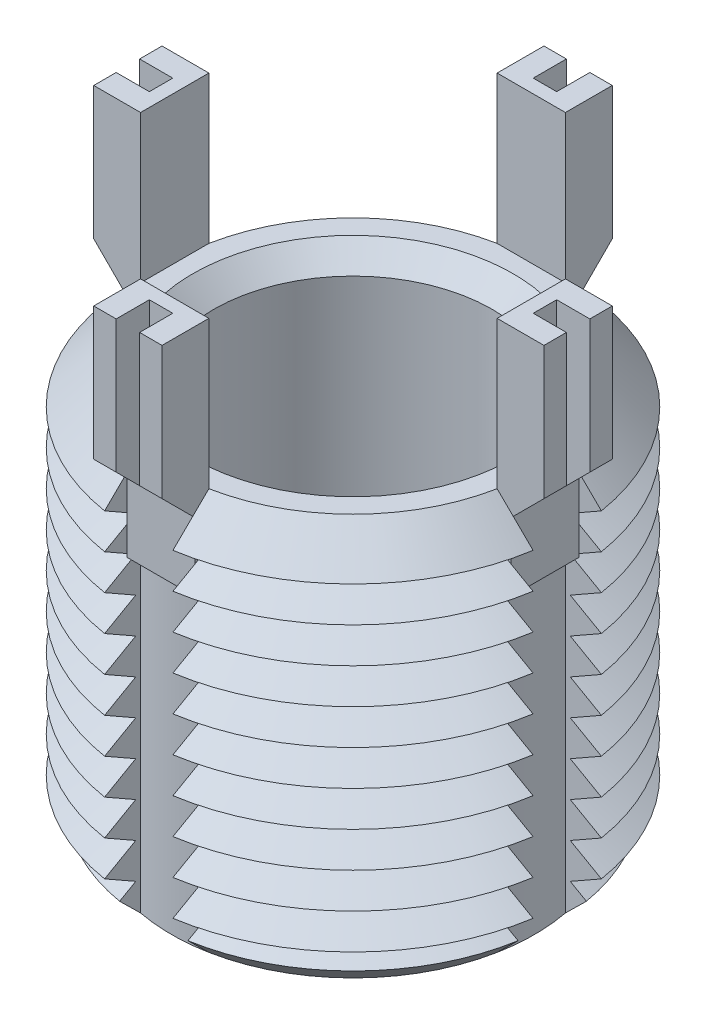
SolidWorks part; units mm, degrees
ref_plane "Front Plane" through (0, 0, 0) normal (0, 0, 1) x (1, 0, 0)
ref_plane "Top Plane" through (0, 0, 0) normal (0, 1, 0) x (1, 0, 0)
ref_plane "Right Plane" through (0, 0, 0) normal (1, 0, 0) x (0, 0, -1)
sketch "Sketch1" plane through (0, 0, 0) normal (0, 1, 0) x (1, 0, 0)
  circle A0 centre (0, 0) radius 11.1125
  dimension "D1" = 22.225
extrude "Boss-Extrude1" add sketch "Sketch1" against normal blind 20.574
chamfer "Chamfer1" distance 1.814 angle 45 2 edges at (0, -20.574, 11.1125) (0, 0, 11.1125)
sketch "Sketch2" plane through (0, 0, 0) normal (1, 0, 0) x (0, 0, -1)
  line L0 (0, 0.8859) -> (0, -9.2617) construction
sketch "Sketch3" plane through (0, 0, 0) normal (1, 0, 0) x (0, 0, -1)
  line L0 (-11.1125, -1.814) -> (-9.5415, -2.721)
  line L1 (-9.5415, -2.721) -> (-11.1125, -3.628)
  line L2 (-11.1125, -1.814) -> (-11.1125, -18.76) construction
  line L3 (-11.1125, -3.628) -> (-11.1125, -1.814)
  dimension "D1" = 1.814
revolve "Cut-Revolve1" cut sketch "Sketch3" angle 360 about L0
pattern_linear "LPattern1" count 10 spacing 1.814 along (0, -1, 0) of "Cut-Revolve1"
sketch "Sketch4" plane through (0, 0, 0) normal (0, 1, 0) x (1, 0, 0)
  line L0 (-9.1323, 1.75) -> (-10.9738, 1.75)
  line L2 (-10.9738, -1.75) -> (-9.1323, -1.75)
  arc A0 (-9.1323, 1.75) -> (-9.1323, -1.75) centre (0, 0) ccw
  arc A1 (-10.9738, 1.75) -> (-10.9738, -1.75) centre (0, 0) ccw
  circle A2 centre (0, 0) radius 11.1125 construction
  circle A3 centre (0, 0) radius 9.2985 construction
  point P1 (-9.2985, 0)
  point P3 (-11.1125, 0)
  point P13 (0, 0)
  dimension "D1" = 3.5
extrude "Cut-Extrude1" cut sketch "Sketch4" against normal up to surface (20.574 mm away)
pattern_circular "CirPattern1" count 4 over 360 about axis through (0, 0, 0) along (0, 1, 0) of "Cut-Extrude1"
sketch "Sketch5" plane through (0, 0, 0) normal (1, 0, 0) x (0, 0, -1)
  line L0 (-9.1323, 7.558) -> (-9.1323, -4.442)
  line L1 (-9.1323, -4.442) -> (-9.8323, -4.442)
  line L2 (-9.8323, -4.442) -> (-9.8323, -0.942)
  line L3 (-9.8323, -0.942) -> (-11.5323, 0.758)
  line L4 (-11.5323, 0.758) -> (-11.5323, 7.558)
  line L5 (-11.5323, 7.558) -> (-9.1323, 7.558)
  line L6 (-10.9738, -5.442) -> (-1.75, -5.442) construction
  point P9 (-1.75, 0)
  point P10 (-9.8323, -0.942)
  dimension "D1" = 1
  dimension "D2" = 12
  dimension "D3" = 8.5
  dimension "D4" = 2.4
  dimension "D5" = 0.7
  dimension "D6" = 45
extrude "Boss-Extrude3" add sketch "Sketch5" along normal mid plane 3.5
pattern_circular "CirPattern2" count 4 over 360 about axis through (0, 0, 0) along (0, 1, 0) of "Boss-Extrude3"
sketch "Sketch6" plane through (0, 7.558, 0) normal (0, 1, 0) x (1, 0, 0)
  line L0 (-11.5323, -1.75) -> (-11.5323, 1.75) construction
  line L1 (-11.5323, -0.6) -> (-9.8323, -0.6)
  line L2 (-11.5323, -0.6) -> (-11.5323, 0.6)
  line L3 (-11.5323, 0.6) -> (-9.8323, 0.6)
  line L4 (-9.8323, -0.6) -> (-9.8323, 0.6)
  line L5 (-11.5323, -0.6) -> (-9.8323, 0.6) construction
  line L6 (-11.5323, 0.6) -> (-9.8323, -0.6) construction
  line L7 (11.5323, 1.75) -> (11.5323, -1.75) construction
  line L8 (-0.6, 9.8323) -> (0.6, 9.8323)
  line L9 (-0.6, 9.8323) -> (-0.6, 11.5323)
  line L10 (-0.6, 11.5323) -> (0.6, 11.5323)
  line L11 (0.6, 9.8323) -> (0.6, 11.5323)
  line L12 (-0.6, 9.8323) -> (0.6, 11.5323) construction
  line L13 (-0.6, 11.5323) -> (0.6, 9.8323) construction
  line L14 (9.8323, -0.6) -> (11.5323, -0.6)
  line L15 (9.8323, -0.6) -> (9.8323, 0.6)
  line L16 (9.8323, 0.6) -> (11.5323, 0.6)
  line L17 (11.5323, -0.6) -> (11.5323, 0.6)
  line L18 (9.8323, -0.6) -> (11.5323, 0.6) construction
  line L19 (9.8323, 0.6) -> (11.5323, -0.6) construction
  line L20 (-0.6, -11.5323) -> (0.6, -11.5323)
  line L21 (-0.6, -11.5323) -> (-0.6, -9.8323)
  line L22 (-0.6, -9.8323) -> (0.6, -9.8323)
  line L23 (0.6, -11.5323) -> (0.6, -9.8323)
  line L24 (-0.6, -11.5323) -> (0.6, -9.8323) construction
  line L25 (-0.6, -9.8323) -> (0.6, -11.5323) construction
  line L26 (-1.75, 11.5323) -> (1.75, 11.5323) construction
  line L27 (1.75, -11.5323) -> (-1.75, -11.5323) construction
  point P0 (-10.6823, 0)
  point P7 (-11.5323, 0)
  point P8 (-11.5323, 0)
  point P9 (0, 10.6823)
  point P14 (10.6823, 0)
  point P19 (0, -10.6823)
  point P24 (0, 11.5323)
  point P25 (11.5323, 0)
  point P26 (11.5323, 0)
  point P27 (0, 11.5323)
  point P30 (0, -11.5323)
  point P33 (0, -11.5323)
  dimension "D1" = 1.2
  dimension "D2" = 1.7
extrude "Cut-Extrude3" cut sketch "Sketch6" against normal through all both and the other way through all
sketch "Sketch7" plane through (0, 0, 0) normal (0, 1, 0) x (1, 0, 0)
  circle A0 centre (0, 0) radius 7.144
  dimension "D1" = 14.288
extrude "Cut-Extrude4" cut sketch "Sketch7" against normal up to surface (20.574 mm away)
chamfer "Chamfer2" distance 1.0585 angle 45 2 edges at (0, 0, 7.144) (0, -20.574, 7.144)
